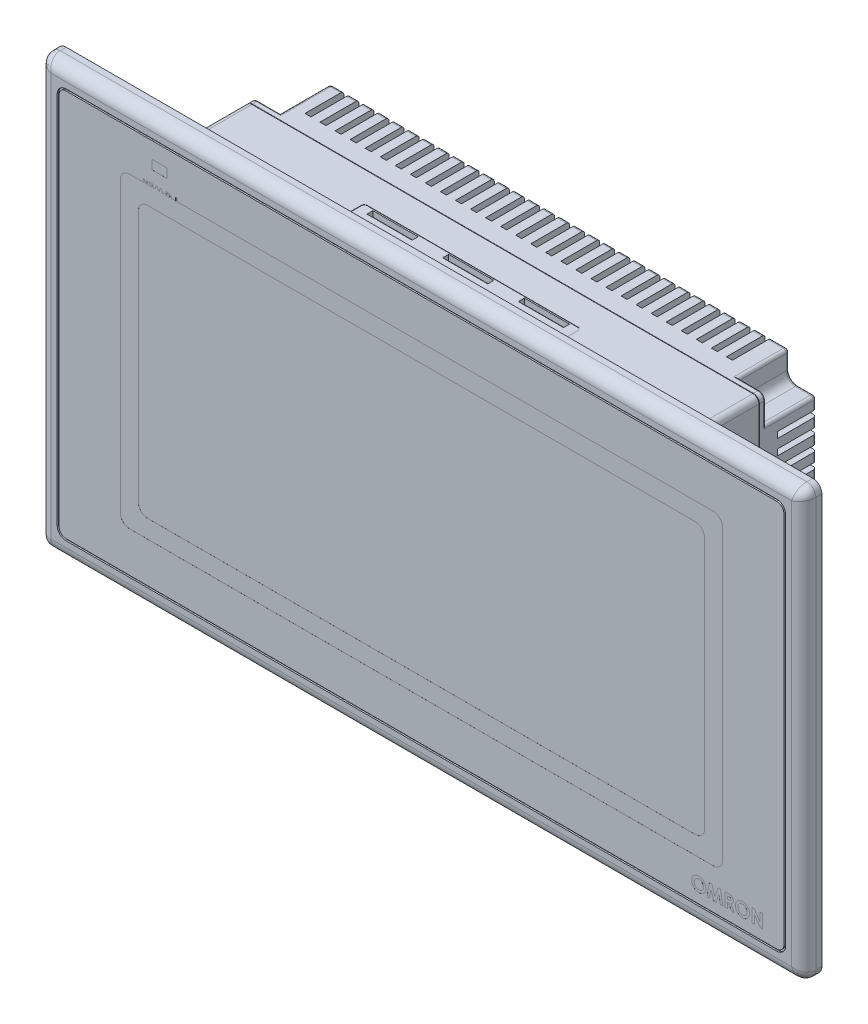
SolidWorks part; units mm, degrees
other "<RS232>-<Boss-Extrude12>"
other "<RS232>-<Cut-Extrude1[2]>"
other "<RS232>-<Cut-Extrude1[1]>"
other "<RS232>-<#4-40 Tapped Hole1[2]>"
other "<RS232>-<Boss-Extrude10[4]>"
other "<RS232>-<Boss-Extrude10[3]>"
other "<RS232>-<Boss-Extrude10[2]>"
other "<RS232>-<Boss-Extrude10[1]>"
other "<RS232>-<Boss-Extrude9[4]>"
other "<RS232>-<Boss-Extrude9[3]>"
other "<RS232>-<Boss-Extrude9[2]>"
other "<RS232>-<Boss-Extrude9[1]>"
other "Camera1"
other "Camera3"
ref_plane "Front Plane" through (0, 0, 0) normal (0, 0, 1) x (1, 0, 0)
ref_plane "Top Plane" through (0, 0, 0) normal (0, 1, 0) x (1, 0, 0)
ref_plane "Right Plane" through (0, 0, 0) normal (1, 0, 0) x (0, 0, -1)
sketch "Sketch1" plane through (0, 0, 0) normal (0, 0, 1) x (1, 0, 0)
  line L1 (127, -71) -> (-127, -71)
  line L2 (127, -71) -> (127, 71)
  line L3 (127, 71) -> (-127, 71)
  line L4 (-127, -71) -> (-127, 71)
  line L5 (127, -71) -> (-127, 71) construction
  line L6 (127, 71) -> (-127, -71) construction
  point P0 (0, 0)
  dimension "D1" = 254
  dimension "D2" = 142
extrude "Boss-Extrude1" add sketch "Sketch1" along normal blind 6
fillet "Fillet2" radius 3 4 edges at (127, -71, 3) (-127, -71, 3) (127, 71, 3) (-127, 71, 3)
fillet "Fillet1" radius 4 8 edges at (0, 71, 6) (127, 0, 6) (0, -71, 6) (-127, 0, 6) (-126.1213, -70.1213, 6) (-126.1213, 70.1213, 6) (126.1213, 70.1213, 6) (126.1213, -70.1213, 6)
sketch "Sketch2" plane through (0, 0, 6) normal (0, 0, 1) x (1, 0, 0)
  line L0 (-127, -68) -> (-127, 68) construction
  line L1 (118, -65) -> (-118, -65)
  line L2 (121, -62) -> (121, 62)
  line L3 (118, 65) -> (-118, 65)
  line L4 (-121, -62) -> (-121, 62)
  line L5 (121, -65) -> (-121, 65) construction
  line L6 (121, 65) -> (-121, -65) construction
  line L7 (-124, 71) -> (124, 71) construction
  arc A0 (-118, -65) -> (-121, -62) centre (-118, -62) cw
  arc A1 (118, -65) -> (121, -62) centre (118, -62) ccw
  arc A2 (121, 62) -> (118, 65) centre (118, 62) ccw
  arc A3 (-118, 65) -> (-121, 62) centre (-118, 62) ccw
  point P0 (0, 0)
  dimension "D1" = 3
  dimension "D2" = 6
  dimension "D3" = 6
extrude "Cut-Extrude1" cut sketch "Sketch2" against normal blind 0.5
sketch "Sketch3" plane through (0, 0, 5.5) normal (0, 0, 1) x (1, 0, 0)
  line L9 (120.4, -62) -> (120.4, 62)
  line L10 (-118, -64.4) -> (118, -64.4)
  line L11 (-120.4, 62) -> (-120.4, -62)
  line L12 (118, 64.4) -> (-118, 64.4)
  line L13 (120.4, -62) -> (120.4, 62)
  line L14 (-118, -64.4) -> (118, -64.4)
  line L15 (-120.4, 62) -> (-120.4, -62)
  line L16 (118, 64.4) -> (-118, 64.4)
  arc A8 (120.4, 62) -> (118, 64.4) centre (118, 62) ccw
  arc A9 (118, -64.4) -> (120.4, -62) centre (118, -62) ccw
  arc A10 (-120.4, -62) -> (-118, -64.4) centre (-118, -62) ccw
  arc A11 (-118, 64.4) -> (-120.4, 62) centre (-118, 62) ccw
  arc A12 (120.4, 62) -> (118, 64.4) centre (118, 62) ccw
  arc A13 (118, -64.4) -> (120.4, -62) centre (118, -62) ccw
  arc A14 (-120.4, -62) -> (-118, -64.4) centre (-118, -62) ccw
  arc A15 (-118, 64.4) -> (-120.4, 62) centre (-118, 62) ccw
  dimension "D1" = 0.6
extrude "Boss-Extrude2" add sketch "Sketch3" along normal up to surface (0.5 mm away)
sketch "Sketch4" plane through (0, 0, 6) normal (0, 0, 1) x (1, 0, 0)
  line L0 (-127, -68) -> (-127, 68) construction
  line L1 (97, -51) -> (-97, -51)
  line L2 (100, -48) -> (100, 48)
  line L3 (97, 51) -> (-97, 51)
  line L4 (-100, -48) -> (-100, 48)
  line L5 (100, -51) -> (-100, 51) construction
  line L6 (100, 51) -> (-100, -51) construction
  line L7 (124, -71) -> (-124, -71) construction
  arc A0 (100, 48) -> (97, 51) centre (97, 48) ccw
  arc A1 (97, -51) -> (100, -48) centre (97, -48) ccw
  arc A2 (-97, -51) -> (-100, -48) centre (-97, -48) cw
  arc A3 (-97, 51) -> (-100, 48) centre (-97, 48) ccw
  point P0 (0, 0)
  dimension "D1" = 3
  dimension "D2" = 27
  dimension "D3" = 20
extrude "Cut-Extrude2" cut sketch "Sketch4" against normal blind 0.01
sketch "Sketch5" plane through (0, 0, 5.99) normal (0, 0, 1) x (1, 0, 0)
  line L0 (91, 45) -> (-91, 45)
  line L1 (-94, 42) -> (-94, -42)
  line L2 (-91, -45) -> (91, -45)
  line L3 (94, -42) -> (94, 42)
  line L4 (97, 51) -> (-97, 51)
  line L5 (-100, 48) -> (-100, -48)
  line L6 (-97, -51) -> (97, -51)
  line L7 (100, -48) -> (100, 48)
  line L8 (97, 51) -> (-97, 51) construction
  line L9 (-100, 48) -> (-100, -48)
  line L10 (-97, -51) -> (97, -51) construction
  line L11 (100, -48) -> (100, 48) construction
  line L12 (-94, 48) -> (-94, -48) construction
  line L13 (97, 45) -> (-97, 45) construction
  line L14 (-97, -45) -> (97, -45) construction
  line L15 (94, -48) -> (94, 48) construction
  arc A0 (94, 42) -> (91, 45) centre (91, 42) ccw
  arc A1 (94, -42) -> (91, -45) centre (91, -42) cw
  arc A2 (-91, -45) -> (-94, -42) centre (-91, -42) cw
  arc A3 (-94, 42) -> (-91, 45) centre (-91, 42) cw
  arc A4 (100, 48) -> (97, 51) centre (97, 48) ccw
  arc A5 (-97, 51) -> (-100, 48) centre (-97, 48) ccw
  arc A6 (-100, -48) -> (-97, -51) centre (-97, -48) ccw
  arc A7 (97, -51) -> (100, -48) centre (97, -48) ccw
  arc A8 (100, 48) -> (97, 51) centre (97, 48) ccw construction
  arc A9 (-97, 51) -> (-100, 48) centre (-97, 48) ccw construction
  arc A10 (-100, -48) -> (-97, -51) centre (-97, -48) ccw construction
  arc A11 (97, -51) -> (100, -48) centre (97, -48) ccw construction
  dimension "D3" = 3
  dimension "D1" = 0
  dimension "D2" = 6
extrude "Cut-Extrude3" cut sketch "Sketch5" against normal blind 0.01 contours A3 L1 A2 L2 A1 L3 A0 L0
sketch "Sketch6" plane through (0, 0, 6) normal (0, 0, 1) x (1, 0, 0)
  line L0 (-62.0158, 52) -> (-111.9842, 52) construction
  line L1 (-89.5, 59) -> (-84.5, 59)
  line L2 (-89.5, 59) -> (-89.5, 56)
  line L3 (-89.5, 56) -> (-84.5, 56)
  line L4 (-84.5, 59) -> (-84.5, 56)
  line L5 (97, 51) -> (-97, 51) construction
  line L6 (-87, 56) -> (-87, 52) construction
  line L7 (-127, -68) -> (-127, 68) construction
  line L8 (77, -61) -> (127, -61) construction
  line L9 (124, -71) -> (-124, -71) construction
  line L10 (127, 68) -> (127, -68) construction
  text T0 "<b>POWER</b>" font "Century Gothic" height 2.5
  text T1 "<b>OMRON</b>" font "Century Gothic" height 4.5
  dimension "D1" = 1
  dimension "D2" = 5
  dimension "D3" = 3
  dimension "D4" = 40
  dimension "D5" = 4
  dimension "D6" = 10
  dimension "D7" = 50
extrude "Cut-Extrude4" cut sketch "Sketch6" against normal blind 0.01
sketch "Sketch7" plane through (0, 0, 0) normal (0, 0, -1) x (-1, 0, 0)
  line L1 (85.2, -64.5) -> (-85.2, -64.5)
  line L2 (85.2, -64.5) -> (85.2, 64.5)
  line L3 (85.2, 64.5) -> (-85.2, 64.5)
  line L4 (-85.2, -64.5) -> (-85.2, 64.5)
  line L5 (85.2, -64.5) -> (-85.2, 64.5) construction
  line L6 (85.2, 64.5) -> (-85.2, -64.5) construction
  point P0 (0, 0)
  dimension "D1" = 170.4
  dimension "D2" = 129
extrude "Boss-Extrude3" add sketch "Sketch7" along normal blind 21
fillet "Fillet3" radius 2 4 edges at (-85.2, -64.5, -10.5) (-85.2, 64.5, -10.5) (85.2, -64.5, -10.5) (85.2, 64.5, -10.5)
sketch "Sketch9" plane through (0, 0, -21) normal (0, 0, -1) x (-1, 0, 0)
  line L4 (-83.2, -64.5) -> (83.2, -64.5)
  line L5 (85.2, -62.5) -> (85.2, 62.5)
  line L6 (83.2, 64.5) -> (-83.2, 64.5)
  line L7 (-85.2, 62.5) -> (-85.2, -62.5)
  line L8 (-83.2, -64.5) -> (83.2, -64.5)
  line L9 (85.2, -62.5) -> (85.2, 62.5)
  line L10 (83.2, 64.5) -> (-83.2, 64.5)
  line L11 (-85.2, 62.5) -> (-85.2, -62.5)
  arc A4 (83.2, -64.5) -> (85.2, -62.5) centre (83.2, -62.5) ccw
  arc A5 (85.2, 62.5) -> (83.2, 64.5) centre (83.2, 62.5) ccw
  arc A6 (-83.2, 64.5) -> (-85.2, 62.5) centre (-83.2, 62.5) ccw
  arc A7 (-85.2, -62.5) -> (-83.2, -64.5) centre (-83.2, -62.5) ccw
  arc A8 (83.2, -64.5) -> (85.2, -62.5) centre (83.2, -62.5) ccw
  arc A9 (85.2, 62.5) -> (83.2, 64.5) centre (83.2, 62.5) ccw
  arc A10 (-83.2, 64.5) -> (-85.2, 62.5) centre (-83.2, 62.5) ccw
  arc A11 (-85.2, -62.5) -> (-83.2, -64.5) centre (-83.2, -62.5) ccw
  dimension "D1" = 0
extrude "Boss-Extrude5" add sketch "Sketch9" along normal offset from surface (19 mm away) 40 separate body
sketch "Sketch8" plane through (0, 0, -40) normal (0, 0, -1) x (-1, 0, 0)
  line L0 (83.2, 64.5) -> (-83.2, 64.5) construction
  line L1 (-76.2, 64.5) -> (-85.2, 64.5)
  line L2 (-76.2, 64.5) -> (-76.2, 58.5)
  line L3 (-79.2, 55.5) -> (-85.2, 55.5)
  line L4 (-85.2, 64.5) -> (-85.2, 55.5)
  line L5 (-85.2, 62.5) -> (-85.2, -62.5) construction
  line L6 (85.2, -62.5) -> (85.2, 62.5) construction
  line L7 (76.2, 64.5) -> (85.2, 64.5)
  line L8 (76.2, 64.5) -> (76.2, 58.5)
  line L9 (79.2, 55.5) -> (85.2, 55.5)
  line L10 (85.2, 64.5) -> (85.2, 55.5)
  line L11 (-83.2, -64.5) -> (83.2, -64.5) construction
  line L12 (85.2, -55.5) -> (79.2, -55.5)
  line L13 (85.2, -55.5) -> (85.2, -64.5)
  line L14 (85.2, -64.5) -> (76.2, -64.5)
  line L15 (76.2, -58.5) -> (76.2, -64.5)
  line L16 (-83.2, -64.5) -> (83.2, -64.5) construction
  line L17 (-85.2, -55.5) -> (-79.2, -55.5)
  line L18 (-85.2, -55.5) -> (-85.2, -64.5)
  line L19 (-85.2, -64.5) -> (-76.2, -64.5)
  line L20 (-76.2, -58.5) -> (-76.2, -64.5)
  arc A0 (76.2, 58.5) -> (79.2, 55.5) centre (79.2, 58.5) ccw
  arc A1 (79.2, -55.5) -> (76.2, -58.5) centre (79.2, -58.5) ccw
  arc A2 (-79.2, -55.5) -> (-76.2, -58.5) centre (-79.2, -58.5) cw
  arc A3 (-76.2, 58.5) -> (-79.2, 55.5) centre (-79.2, 58.5) cw
  dimension "D1" = 3
  dimension "D2" = 9
  dimension "D3" = 9
extrude "Cut-Extrude5" cut sketch "Sketch8" against normal blind 17
fillet "Fillet4" radius 1 8 edges at (76.2, -64.5, -31.5) (85.2, -55.5, -31.5) (-76.2, -64.5, -31.5) (-85.2, -55.5, -31.5) (-85.2, 55.5, -31.5) (-76.2, 64.5, -31.5) (85.2, 55.5, -31.5) (76.2, 64.5, -31.5)
fillet "Fillet5" radius 1 20 edges at (81.7, -55.5, -40) (76.2, -61, -40) (85.2, 0, -40) (0, -64.5, -40) (-81.7, -55.5, -40) (-85.2, 0, -40) (-76.2, 61, -40) (0, 64.5, -40) (81.7, 55.5, -40) (75.9071, 64.2071, -40) (84.9071, 55.2071, -40) (-75.9071, 64.2071, -40) (-84.9071, 55.2071, -40) (-84.9071, -55.2071, -40) (-75.9071, -64.2071, -40) (84.9071, -55.2071, -40) (75.9071, -64.2071, -40) (76.2, 61, -40) (-81.7, 55.5, -40) (-76.2, -61, -40)
sketch "Sketch10" plane through (0, 0, -40) normal (0, 0, -1) x (-1, 0, 0)
  line L0 (-75.2, 64.5) -> (75.2, 64.5) construction
  line L1 (-70.2, 64.5) -> (-68.2, 64.5)
  line L2 (-70.2, 64.5) -> (-70.2, 60)
  line L3 (-70.2, 60) -> (-68.2, 60)
  line L4 (-68.2, 64.5) -> (-68.2, 60)
  line L5 (-76.2, 58.5) -> (-76.2, 63.5) construction
  line L6 (-84.2, 0) -> (0, 0) construction
  line L7 (-84.2, 54.5) -> (-84.2, -54.5) construction
  line L8 (-68.2, -64.5) -> (-68.2, -60)
  line L9 (-70.2, -60) -> (-68.2, -60)
  line L10 (-70.2, -64.5) -> (-70.2, -60)
  line L11 (-70.2, -64.5) -> (-68.2, -64.5)
  point P6 (-76.2, 61)
  dimension "D1" = 2
  dimension "D2" = 6
  dimension "D3" = 4.5
extrude "Cut-Extrude6" cut sketch "Sketch10" against normal blind 12.9
pattern_linear "LPattern1" count 29 spacing 5 along (-1, 0, 0) of "Cut-Extrude6"
sketch "Sketch11" plane through (0, 0, -40) normal (0, 0, -1) x (-1, 0, 0)
  line L0 (-85.2, 62.5) -> (-85.2, -62.5) construction
  line L1 (-85.2, 51.5) -> (-80.7, 51.5)
  line L2 (-85.2, 51.5) -> (-85.2, 49.5)
  line L3 (-85.2, 49.5) -> (-80.7, 49.5)
  line L4 (-80.7, 51.5) -> (-80.7, 49.5)
  line L5 (-70.2, 64.5) -> (-70.2, 60) construction
  line L6 (-70.2, 60) -> (-68.2, 60) construction
  line L7 (0, 0) -> (0, 71) construction
  line L8 (-124, 71) -> (124, 71) construction
  line L9 (80.7, 51.5) -> (80.7, 49.5)
  line L10 (85.2, 49.5) -> (80.7, 49.5)
  line L11 (85.2, 51.5) -> (85.2, 49.5)
  line L12 (85.2, 51.5) -> (80.7, 51.5)
  line L13 (-79.2, 54.5) -> (-84.2, 54.5) construction
  point P19 (-81.7, 54.5)
  dimension "D1" = 3
extrude "Cut-Extrude7" cut sketch "Sketch11" against normal up to surface (12.9 mm away)
pattern_linear "LPattern2" count 21 spacing 5 along (0, -1, 0) of "Cut-Extrude7"
sketch "Sketch14" plane through (40.2, 0, 0) normal (1, 0, 0) x (0, 0, -1)
  line L4 (40, -63.5) -> (40, -60)
  line L5 (40, -60) -> (27.1, -60)
  line L6 (27.1, -60) -> (27.1, -64.5)
  line L7 (27.1, -64.5) -> (39, -64.5)
  line L8 (40, -63.5) -> (40, -60)
  line L9 (40, -60) -> (27.1, -60)
  line L10 (27.1, -60) -> (27.1, -64.5)
  line L11 (27.1, -64.5) -> (39, -64.5)
  arc A1 (39, -64.5) -> (40, -63.5) centre (39, -63.5) ccw
  arc A2 (39, -64.5) -> (40, -63.5) centre (39, -63.5) ccw
  dimension "D1" = 0
extrude "Boss-Extrude6" add sketch "Sketch14" against normal up to surface (112 mm away)
sketch "Sketch12" plane through (0, 0, -40) normal (0, 0, -1) x (-1, 0, 0)
  line L0 (-83.2, -64.5) -> (83.2, -64.5) construction
  line L1 (-36.8, -20.5) -> (62.2, -20.5)
  line L2 (-39.8, -23.5) -> (-39.8, -64.5)
  line L3 (-39.8, -64.5) -> (65.2, -64.5)
  line L4 (65.2, -23.5) -> (65.2, -64.5)
  line L5 (85.2, -62.5) -> (85.2, 62.5) construction
  line L6 (83.2, 64.5) -> (-83.2, 64.5) construction
  arc A0 (62.2, -20.5) -> (65.2, -23.5) centre (62.2, -23.5) cw
  arc A1 (-36.8, -20.5) -> (-39.8, -23.5) centre (-36.8, -23.5) ccw
  point P12 (65.2, -20.5)
  point P15 (-39.8, -20.5)
  dimension "D4" = 3
  dimension "D1" = 105
  dimension "D2" = 20
  dimension "D3" = 85
extrude "Cut-Extrude8" cut sketch "Sketch12" against normal blind 6.5
sketch "Sketch13" plane through (0, 0, -33.5) normal (0, 0, -1) x (-1, 0, 0)
  line L0 (62.2, -20.5) -> (-36.8, -20.5) construction
  line L1 (21.2, -20.5) -> (62.2, -20.5)
  line L2 (20.2, -21.5) -> (20.2, -64.5)
  line L3 (20.2, -64.5) -> (65.2, -64.5)
  line L4 (65.2, -23.5) -> (65.2, -64.5)
  line L5 (65.2, -63.5) -> (65.2, -23.5) construction
  arc A0 (21.2, -20.5) -> (20.2, -21.5) centre (21.2, -21.5) ccw
  arc A1 (65.2, -23.5) -> (62.2, -20.5) centre (62.2, -23.5) ccw construction
  arc A2 (65.2, -23.5) -> (62.2, -20.5) centre (62.2, -23.5) ccw
  point P12 (20.2, -20.5)
  dimension "D1" = 1
  dimension "D2" = 45
extrude "Cut-Extrude9" cut sketch "Sketch13" against normal blind 4.3
sketch "Sketch15" plane through (0, 0, -40) normal (0, 0, -1) x (-1, 0, 0)
  line L0 (-85.2, 62.5) -> (-85.2, -62.5) construction
  line L1 (-71.2, -16.5) -> (-85.2, -16.5)
  line L2 (-71.2, -16.5) -> (-71.2, -43.5)
  line L3 (-71.2, -43.5) -> (-85.2, -43.5)
  line L4 (-85.2, -16.5) -> (-85.2, -43.5)
  line L5 (-83.2, -64.5) -> (83.2, -64.5) construction
  dimension "D1" = 27
  dimension "D2" = 14
  dimension "D3" = 21
extrude "Cut-Extrude10" cut sketch "Sketch15" against normal blind 12.3
sketch "Sketch16" plane through (0, 0, -27.7) normal (0, 0, -1) x (-1, 0, 0)
  line L0 (-85.2, -40.5) -> (-85.2, -43.5) construction
  line L1 (-71.2, -16.5) -> (-85.2, -16.5)
  line L2 (-71.2, -16.5) -> (-71.2, -43.5)
  line L3 (-71.2, -43.5) -> (-85.2, -43.5)
  line L4 (-85.2, -16.5) -> (-85.2, -43.5)
extrude "Boss-Extrude7" add sketch "Sketch16" against normal up to next
sketch "Sketch17" plane through (0, -45.5, 0) normal (0, 1, 0) x (1, 0, 0)
  line L4 (84.2, 40) -> (80.7, 40)
  line L5 (80.7, 40) -> (80.7, 27.1)
  line L6 (80.7, 27.1) -> (85.2, 27.1)
  line L7 (85.2, 27.1) -> (85.2, 39)
  line L8 (84.2, 40) -> (80.7, 40)
  line L9 (80.7, 40) -> (80.7, 27.1)
  line L10 (80.7, 27.1) -> (85.2, 27.1)
  line L11 (85.2, 27.1) -> (85.2, 39)
  arc A1 (85.2, 39) -> (84.2, 40) centre (84.2, 39) ccw
  arc A2 (85.2, 39) -> (84.2, 40) centre (84.2, 39) ccw
  dimension "D1" = 0
extrude "Boss-Extrude8" add sketch "Sketch17" along normal up to surface (2 mm away)
sketch "Sketch18" plane through (0, -15.5, 0) normal (0, 1, 0) x (1, 0, 0)
  line L4 (84.2, 40) -> (80.7, 40)
  line L5 (80.7, 40) -> (80.7, 27.1)
  line L6 (80.7, 27.1) -> (85.2, 27.1)
  line L7 (85.2, 27.1) -> (85.2, 39)
  line L8 (84.2, 40) -> (80.7, 40)
  line L9 (80.7, 40) -> (80.7, 27.1)
  line L10 (80.7, 27.1) -> (85.2, 27.1)
  line L11 (85.2, 27.1) -> (85.2, 39)
  arc A1 (85.2, 39) -> (84.2, 40) centre (84.2, 39) ccw
  arc A2 (85.2, 39) -> (84.2, 40) centre (84.2, 39) ccw
  dimension "D1" = 0
extrude "Boss-Extrude9" add sketch "Sketch18" along normal up to next
sketch "Sketch19" plane through (0, 0, -21) normal (0, 0, -1) x (-1, 0, 0)
  line L8 (-83.2, -62.5) -> (83.2, -62.5)
  line L9 (83.2, -62.5) -> (83.2, 62.5)
  line L10 (83.2, 62.5) -> (-83.2, 62.5)
  line L11 (-83.2, 62.5) -> (-83.2, -62.5)
  line L12 (-83.2, -62.5) -> (83.2, -62.5)
  line L13 (83.2, -62.5) -> (83.2, 62.5)
  line L14 (83.2, 62.5) -> (-83.2, 62.5)
  line L15 (-83.2, 62.5) -> (-83.2, -62.5)
  dimension "D1" = 2
extrude "Cut-Extrude11" cut sketch "Sketch19" against normal offset from surface (19 mm away) 2
sketch "Sketch20" plane through (0, 0, -27.7) normal (0, 0, -1) x (-1, 0, 0)
  line L0 (-85.2, -43.5) -> (-71.2, -43.5) construction
  line L1 (-71.2, -16.5) -> (-82.2, -16.5)
  line L2 (-71.2, -16.5) -> (-71.2, -43.5)
  line L3 (-71.2, -43.5) -> (-82.2, -43.5)
  line L4 (-82.2, -16.5) -> (-82.2, -43.5)
  line L5 (-85.2, -16.5) -> (-85.2, -43.5) construction
  point P7 (-85.2, -30)
  dimension "D1" = 3
extrude "Cut-Extrude12" cut sketch "Sketch20" against normal blind 20 and the other way through all
shell "Shell3" thickness 2
sketch "Sketch21" plane through (0, 0, -25.1) normal (0, 0, 1) x (1, 0, 0)
  line L0 (-78.7, 53.5) -> (-79.2, 53.5) construction
  line L1 (-79.2, 53.5) -> (-83.2, 53.5) construction
  line L2 (-83.2, 53.5) -> (-83.2, -52.5) construction
  line L3 (-83.2, -52.5) -> (-78.7, -52.5) construction
  line L4 (-73.8, 58) -> (72.2, 58)
  line L5 (72.2, 58) -> (72.2, 62.5)
  line L6 (72.2, 62.5) -> (-73.8, 62.5)
  line L7 (-73.8, 62.5) -> (-73.8, 58)
  line L8 (-73.8, 58) -> (72.2, 58)
  line L9 (72.2, 58) -> (72.2, 62.5)
  line L10 (72.2, 62.5) -> (-73.8, 62.5)
  line L11 (-73.8, 62.5) -> (-73.8, 58)
  line L12 (-78.7, -52.5) -> (-78.7, 53.5) construction
  line L13 (72.2, -58) -> (41.2, -58) construction
  line L14 (41.2, -58) -> (41.2, -62.5) construction
  line L15 (41.2, -62.5) -> (72.2, -62.5) construction
  line L16 (72.2, -62.5) -> (72.2, -58) construction
  line L17 (83.2, 53.5) -> (79.2, 53.5) construction
  line L18 (79.2, 53.5) -> (78.7, 53.5) construction
  line L19 (78.7, 53.5) -> (78.7, -12.5) construction
  line L20 (78.7, -12.5) -> (83.2, -12.5) construction
  line L21 (83.2, -12.5) -> (83.2, 53.5) construction
  line L22 (-78.7, 53.5) -> (-79.2, 53.5)
  line L23 (-79.2, 53.5) -> (-83.2, 53.5)
  line L24 (-83.2, 53.5) -> (-83.2, -52.5)
  line L25 (-83.2, -52.5) -> (-78.7, -52.5)
  line L26 (-78.7, -52.5) -> (-78.7, 53.5)
  line L27 (72.2, -58) -> (41.2, -58)
  line L28 (41.2, -58) -> (41.2, -62.5)
  line L29 (41.2, -62.5) -> (72.2, -62.5)
  line L30 (72.2, -62.5) -> (72.2, -58)
  line L31 (83.2, 53.5) -> (79.2, 53.5)
  line L32 (79.2, 53.5) -> (78.7, 53.5)
  line L33 (78.7, 53.5) -> (78.7, -12.5)
  line L34 (78.7, -12.5) -> (83.2, -12.5)
  line L35 (83.2, -12.5) -> (83.2, 53.5)
  dimension "D1" = 0
extrude "Cut-Extrude13" cut sketch "Sketch21" against normal blind 10
sketch "Sketch25" plane through (0, 64.5, 0) normal (0, 1, 0) x (1, 0, 0)
  line L0 (0, 0) -> (0, 7) construction
  line L1 (124, 0) -> (-124, 0) construction
  line L2 (-83.2, 0) -> (83.2, 0) construction
  line L3 (-35, 11) -> (35, 11)
  line L4 (-36, 10) -> (-36, 4)
  line L5 (-35, 3) -> (35, 3)
  line L6 (36, 10) -> (36, 4)
  line L7 (-36, 11) -> (36, 3) construction
  line L8 (-36, 3) -> (36, 11) construction
  arc A0 (35, 3) -> (36, 4) centre (35, 4) ccw
  arc A1 (35, 11) -> (36, 10) centre (35, 10) cw
  arc A2 (-36, 4) -> (-35, 3) centre (-35, 4) ccw
  arc A3 (-35, 11) -> (-36, 10) centre (-35, 10) ccw
  dimension "D4" = 1
  dimension "D1" = 72
  dimension "D2" = 8
  dimension "D3" = 3
extrude "Cut-Extrude15" cut sketch "Sketch25" against normal blind 0.1
sketch "Sketch26" plane through (0, 64.4, 0) normal (0, 1, 0) x (1, 0, 0)
  line L0 (0, 11) -> (0, 3) construction
  line L1 (35, 11) -> (-35, 11) construction
  line L2 (-35, 3) -> (35, 3) construction
  line L3 (0, 7) -> (36, 7) construction
  line L4 (-7.5, 10.55) -> (7.5, 10.55)
  line L5 (-7.5, 10.55) -> (-7.5, 8.55)
  line L6 (-7.5, 8.55) -> (7.5, 8.55)
  line L7 (7.5, 10.55) -> (7.5, 8.55)
  line L8 (-7.5, 10.55) -> (7.5, 8.55) construction
  line L9 (-7.5, 8.55) -> (7.5, 10.55) construction
  line L10 (36, 4) -> (36, 10) construction
  line L11 (0, 9.55) -> (25.15, 9.55) construction
  line L12 (-32.65, 8.55) -> (-17.65, 10.55) construction
  line L13 (32.65, 10.55) -> (17.65, 10.55)
  line L14 (32.65, 10.55) -> (32.65, 8.55)
  line L15 (32.65, 8.55) -> (17.65, 8.55)
  line L16 (17.65, 10.55) -> (17.65, 8.55)
  line L17 (32.65, 10.55) -> (17.65, 8.55) construction
  line L18 (32.65, 8.55) -> (17.65, 10.55) construction
  line L19 (-32.65, 10.55) -> (-17.65, 8.55) construction
  line L20 (-17.65, 10.55) -> (-17.65, 8.55)
  line L21 (-32.65, 8.55) -> (-17.65, 8.55)
  line L22 (-32.65, 10.55) -> (-32.65, 8.55)
  line L23 (-32.65, 10.55) -> (-17.65, 10.55)
  line L24 (-32.65, 3.45) -> (-17.65, 5.45) construction
  line L25 (32.65, 5.45) -> (17.65, 3.45) construction
  line L26 (32.65, 3.45) -> (17.65, 5.45) construction
  line L27 (-32.65, 5.45) -> (-17.65, 3.45) construction
  line L28 (0, 4.45) -> (25.15, 4.45) construction
  line L29 (-7.5, 5.45) -> (7.5, 3.45) construction
  line L30 (-7.5, 3.45) -> (7.5, 5.45) construction
  line L31 (-32.65, 3.45) -> (-17.65, 3.45)
  line L32 (-32.65, 3.45) -> (-32.65, 5.45)
  line L33 (-32.65, 5.45) -> (-17.65, 5.45)
  line L34 (-17.65, 3.45) -> (-17.65, 5.45)
  line L35 (17.65, 3.45) -> (17.65, 5.45)
  line L36 (32.65, 5.45) -> (17.65, 5.45)
  line L37 (32.65, 3.45) -> (32.65, 5.45)
  line L38 (32.65, 3.45) -> (17.65, 3.45)
  line L39 (7.5, 3.45) -> (7.5, 5.45)
  line L40 (-7.5, 5.45) -> (7.5, 5.45)
  line L41 (-7.5, 3.45) -> (-7.5, 5.45)
  line L42 (-7.5, 3.45) -> (7.5, 3.45)
  point P6 (0, 9.55)
  dimension "D1" = 15
  dimension "D2" = 2
  dimension "D3" = 65.3
  dimension "D4" = 7.1
extrude "Cut-Extrude16" cut sketch "Sketch26" against normal up to next
fillet "Fillet6" radius 0.1
chamfer "Chamfer1" distance 0.1 angle 45
sketch "Sketch34" plane through (0, 0, -29.2) normal (0, 0, -1) x (-1, 0, 0)
  line L0 (42.7, -20.5) -> (42.7, -64.5) construction
  line L1 (26.5, -23.5) -> (38.2, -23.5)
  line L2 (25.5, -24.5) -> (25.5, -54.5)
  line L3 (26.5, -55.5) -> (38.2, -55.5)
  line L4 (39.2, -24.5) -> (39.2, -54.5)
  line L5 (25.5, -23.5) -> (39.2, -55.5) construction
  line L6 (25.5, -55.5) -> (39.2, -23.5) construction
  line L8 (20.2, -64.5) -> (65.2, -64.5) construction
  line L9 (62.2, -20.5) -> (-36.8, -20.5) construction
  line L10 (59.9, -55.5) -> (46.2, -23.5) construction
  line L11 (59.9, -23.5) -> (46.2, -55.5) construction
  line L12 (46.2, -24.5) -> (46.2, -54.5)
  line L13 (58.9, -55.5) -> (47.2, -55.5)
  line L14 (59.9, -24.5) -> (59.9, -54.5)
  line L15 (58.9, -23.5) -> (47.2, -23.5)
  arc A0 (38.2, -23.5) -> (39.2, -24.5) centre (38.2, -24.5) cw
  arc A1 (38.2, -55.5) -> (39.2, -54.5) centre (38.2, -54.5) ccw
  arc A2 (25.5, -54.5) -> (26.5, -55.5) centre (26.5, -54.5) ccw
  arc A3 (26.5, -23.5) -> (25.5, -24.5) centre (26.5, -24.5) ccw
  arc A4 (58.9, -23.5) -> (59.9, -24.5) centre (58.9, -24.5) cw
  arc A5 (59.9, -54.5) -> (58.9, -55.5) centre (58.9, -54.5) cw
  arc A6 (47.2, -55.5) -> (46.2, -54.5) centre (47.2, -54.5) cw
  arc A7 (47.2, -23.5) -> (46.2, -24.5) centre (47.2, -24.5) ccw
  point P0 (32.35, -39.5)
  point P39 (53.05, -39.5)
  dimension "D1" = 1
  dimension "D2" = 13.7
  dimension "D3" = 32
  dimension "D4" = 3
  dimension "D5" = 7
extrude "Cut-Extrude18" cut sketch "Sketch34" against normal blind 15
sketch "Sketch35" plane through (0, 0, -33.5) normal (0, 0, -1) x (-1, 0, 0)
  line L0 (-39.8, -23.5) -> (-39.8, -64.5) construction
  line L1 (-35.8, -41.1) -> (-23.1, -41.1)
  line L2 (-35.8, -41.1) -> (-35.8, -54.6)
  line L3 (-35.8, -54.6) -> (-23.1, -54.6)
  line L4 (-23.1, -41.1) -> (-23.1, -54.6)
  line L5 (-35.8, -41.1) -> (-23.1, -54.6) construction
  line L6 (-35.8, -54.6) -> (-23.1, -41.1) construction
  line L7 (-17.1, -40) -> (-8.7, -40)
  line L8 (-17.1, -40) -> (-17.1, -55.6)
  line L9 (-17.1, -55.6) -> (-8.7, -55.6)
  line L10 (-8.7, -40) -> (-8.7, -55.6)
  line L11 (-17.1, -40) -> (-8.7, -55.6) construction
  line L12 (-17.1, -55.6) -> (-8.7, -40) construction
  line L13 (-3.6, -38.3) -> (13.4, -38.3)
  line L14 (-3.6, -38.3) -> (-3.6, -56.6)
  line L15 (-3.6, -56.6) -> (13.4, -56.6)
  line L16 (13.4, -38.3) -> (13.4, -56.6)
  line L17 (-3.6, -38.3) -> (13.4, -56.6) construction
  line L18 (-3.6, -56.6) -> (13.4, -38.3) construction
  line L19 (-14.7, -25.2) -> (-5.3, -25.2)
  line L20 (-14.7, -25.2) -> (-14.7, -34.6)
  line L21 (-14.7, -34.6) -> (-5.3, -34.6)
  line L22 (-5.3, -25.2) -> (-5.3, -34.6)
  line L23 (-14.7, -25.2) -> (-5.3, -34.6) construction
  line L24 (-14.7, -34.6) -> (-5.3, -25.2) construction
  line L25 (-83.2, -64.5) -> (83.2, -64.5) construction
  line L26 (-39.8, -23.5) -> (-39.8, -63.5) construction
  circle A0 centre (-33.4, -30.5) radius 2
  circle A1 centre (-22.4, -30.5) radius 2.65
  point P0 (-29.45, -47.85)
  point P5 (-12.9, -47.8)
  point P10 (4.9, -47.45)
  point P15 (-10, -29.9)
  dimension "D16" = 5.3
  dimension "D17" = 4
  dimension "D19" = 34
  dimension "D1" = 12.7
  dimension "D2" = 13.5
  dimension "D3" = 4
  dimension "D4" = 9.9
  dimension "D5" = 22.7
  dimension "D6" = 36.2
  dimension "D7" = 17
  dimension "D8" = 7.9
  dimension "D9" = 8.9
  dimension "D10" = 15.6
  dimension "D11" = 18.3
  dimension "D12" = 8.4
  dimension "D13" = 9.4
  dimension "D14" = 25.1
  dimension "D15" = 29.9
  dimension "D18" = 11
  dimension "D20" = 6.4
extrude "Cut-Extrude19" cut sketch "Sketch35" against normal up to surface (31.5 mm away)
sketch "Sketch36" plane through (0, 0, -40) normal (0, 0, -1) x (-1, 0, 0)
  line L0 (83.2, 64.5) -> (-83.2, 64.5) construction
  line L1 (-23.8777, 23.5) -> (23.8777, 23.5)
  line L2 (-25.5, 21.8777) -> (-25.5, -0.8777)
  line L3 (-23.8777, -2.5) -> (23.8777, -2.5)
  line L4 (25.5, 21.8777) -> (25.5, -0.8777)
  line L5 (-25.5, 23.5) -> (25.5, -2.5) construction
  line L6 (-25.5, -2.5) -> (25.5, 23.5) construction
  line L7 (0, 10.5) -> (0, 0) construction
  arc A0 (23.8777, 23.5) -> (25.5, 21.8777) centre (23.8777, 21.8777) cw
  arc A1 (23.8777, -2.5) -> (25.5, -0.8777) centre (23.8777, -0.8777) ccw
  arc A2 (-25.5, -0.8777) -> (-23.8777, -2.5) centre (-23.8777, -0.8777) ccw
  arc A3 (-23.8777, 23.5) -> (-25.5, 21.8777) centre (-23.8777, 21.8777) ccw
  point P0 (0, 10.5)
  dimension "D1" = 1.6223
  dimension "D2" = 41
  dimension "D3" = 51
  dimension "D4" = 26
extrude "Cut-Extrude20" cut sketch "Sketch36" against normal blind 0.2
inserted part "RS232"
move or copy body "Body-Move/Copy2" placed by mates yes
other "Distance1" parameters "D1"=3.2
other "Distance2" parameters "D1"=0.5
other "Distance3" parameters "D1"=7
sketch "Sketch37" plane through (0, 0, -26) normal (0, 0, -1) x (-1, 0, 0)
  line L1 (34.2318, -28.9515) -> (35.0141, -26.4135)
  line L2 (35.0141, -26.4135) -> (33.2073, -24.467)
  line L3 (33.2073, -24.467) -> (30.6182, -25.0585)
  line L4 (30.6182, -25.0585) -> (29.8359, -27.5965)
  line L5 (29.8359, -27.5965) -> (31.6427, -29.543)
  line L6 (31.6427, -29.543) -> (34.2318, -28.9515)
  line L7 (34.1353, -49.9632) -> (31.5205, -49.498)
  line L8 (31.5205, -49.498) -> (29.8103, -51.5298)
  line L9 (29.8103, -51.5298) -> (30.7147, -54.0268)
  line L10 (30.7147, -54.0268) -> (33.3295, -54.492)
  line L11 (33.3295, -54.492) -> (35.0397, -52.4602)
  line L12 (35.0397, -52.4602) -> (34.1353, -49.9632)
  circle A0 centre (32.425, -27.005) radius 2.3 construction
  circle A1 centre (32.425, -51.995) radius 2.3 construction
  dimension "D1" = 4.6
extrude "Boss-Extrude18" add sketch "Sketch37" along normal blind 6.4
chamfer "Chamfer2" distance 0.2 angle 45 12 edges at (-34.1846, -53.4761, -32.4) (-32.0221, -54.2594, -32.4) (-30.2625, -52.7783, -32.4) (-30.6654, -50.5139, -32.4) (-32.8279, -49.7306, -32.4) (-34.5875, -51.2117, -32.4) (-30.7393, -28.5697, -32.4) (-30.227, -26.3275, -32.4) (-31.9128, -24.7628, -32.4) (-34.1107, -25.4403, -32.4) (-34.623, -27.6825, -32.4) (-32.9372, -29.2472, -32.4)
pattern_linear "LPattern3" count 2 spacing 20.7
sketch "Sketch47" plane through (0, 0, -2) normal (0, 0, -1) x (-1, 0, 0)
  line L0 (-29.45, -41.1) -> (-29.45, -54.6) construction
  line L1 (-23.1, -41.1) -> (-35.8, -41.1) construction
  line L2 (-35.8, -54.6) -> (-23.1, -54.6) construction
  line L4 (-34.95, -41.85) -> (-23.95, -41.85)
  line L5 (-35.45, -42.35) -> (-35.45, -53.35)
  line L6 (-34.95, -53.85) -> (-23.95, -53.85)
  line L7 (-23.45, -42.35) -> (-23.45, -53.35)
  line L8 (-35.45, -41.85) -> (-23.45, -53.85) construction
  line L9 (-35.45, -53.85) -> (-23.45, -41.85) construction
  arc A0 (-34.95, -41.85) -> (-35.45, -42.35) centre (-34.95, -42.35) ccw
  arc A1 (-23.95, -41.85) -> (-23.45, -42.35) centre (-23.95, -42.35) cw
  arc A2 (-23.95, -53.85) -> (-23.45, -53.35) centre (-23.95, -53.35) ccw
  arc A3 (-35.45, -53.35) -> (-34.95, -53.85) centre (-34.95, -53.35) ccw
  point P6 (-29.45, -47.85)
  dimension "D3" = 0.5
  dimension "D1" = 12
  dimension "D2" = 12
extrude "Boss-Extrude19" add sketch "Sketch47" along normal offset from surface (32 mm away) 0.5 separate body
sketch "Sketch48" plane through (0, 0, -34) normal (0, 0, -1) x (-1, 0, 0)
  line L0 (-35.45, -47.85) -> (-23.45, -47.85) construction
  line L1 (-35.45, -42.35) -> (-35.45, -53.35) construction
  line L2 (-23.45, -53.35) -> (-23.45, -42.35) construction
  line L3 (-33.05, -52.1) -> (-33.05, -43.6)
  line L4 (-33.05, -43.6) -> (-25.95, -43.6)
  line L5 (-25.95, -43.6) -> (-24.75, -44.8)
  line L6 (-24.75, -44.8) -> (-24.75, -50.9)
  line L7 (-25.95, -52.1) -> (-24.75, -50.9)
  line L8 (-33.05, -52.1) -> (-25.95, -52.1)
  point P12 (-24.75, -47.85)
  point P14 (-33.05, -47.85)
  dimension "D1" = 1.3
  dimension "D2" = 8.5
  dimension "D3" = 8.3
  dimension "D4" = 135
  dimension "D5" = 1.2
extrude "Cut-Extrude21" cut sketch "Sketch48" against normal blind 9
sketch "Sketch49" plane through (0, 0, -25) normal (0, 0, -1) x (-1, 0, 0)
  line L0 (-25.9914, -43.7) -> (-32.95, -43.7)
  line L1 (-32.95, -43.7) -> (-32.95, -52)
  line L2 (-32.95, -52) -> (-25.9914, -52)
  line L3 (-25.9914, -52) -> (-24.85, -50.8586)
  line L4 (-24.85, -50.8586) -> (-24.85, -44.8414)
  line L5 (-24.85, -44.8414) -> (-25.9914, -43.7)
  line L6 (-25.95, -43.6) -> (-33.05, -43.6)
  line L7 (-33.05, -43.6) -> (-33.05, -52.1)
  line L8 (-33.05, -52.1) -> (-25.95, -52.1)
  line L9 (-25.95, -52.1) -> (-24.75, -50.9)
  line L10 (-24.75, -50.9) -> (-24.75, -44.8)
  line L11 (-24.75, -44.8) -> (-25.95, -43.6)
  line L12 (-25.95, -43.6) -> (-33.05, -43.6)
  line L13 (-33.05, -43.6) -> (-33.05, -52.1)
  line L14 (-33.05, -52.1) -> (-25.95, -52.1)
  line L15 (-25.95, -52.1) -> (-24.75, -50.9)
  line L16 (-24.75, -50.9) -> (-24.75, -44.8)
  line L17 (-24.75, -44.8) -> (-25.95, -43.6)
  dimension "D1" = 0
  dimension "D2" = 0.1
extrude "Boss-Extrude20" add sketch "Sketch49" along normal offset from surface (8.5 mm away) 0.5 separate body
sketch "Sketch50" plane through (0, 0, -25) normal (0, 0, -1) x (-1, 0, 0)
  line L0 (-32.95, -47.85) -> (-24.75, -47.85) construction
  line L1 (-32.95, -43.7) -> (-32.95, -52) construction
  line L2 (-24.75, -50.9) -> (-24.75, -44.8) construction
  line L5 (-30.45, -50.6) -> (-27.25, -50.6)
  line L6 (-30.45, -50.6) -> (-30.45, -45.1)
  line L7 (-30.45, -45.1) -> (-27.25, -45.1)
  line L8 (-27.25, -50.6) -> (-27.25, -45.1)
  line L9 (-30.45, -50.6) -> (-27.25, -45.1) construction
  line L10 (-30.45, -45.1) -> (-27.25, -50.6) construction
  point P7 (-28.85, -47.85)
  dimension "D1" = 3.2
  dimension "D2" = 5.5
extrude "Boss-Extrude21" add sketch "Sketch50" along normal up to surface (8.5 mm away) separate body
chamfer "Chamfer3" distance 0.2 angle 45 4 edges at (30.45, -47.85, -33.5) (28.85, -45.1, -33.5) (27.25, -47.85, -33.5) (28.85, -50.6, -33.5)
sketch "Sketch51" plane through (0, 0, -31.5) normal (0, 0, 1) x (1, 0, 0)
  line L0 (-4.9, -38.3) -> (-4.9, -56.6) construction
  line L1 (-13.4, -38.3) -> (3.6, -38.3) construction
  line L2 (3.6, -56.6) -> (-13.4, -56.6) construction
  line L3 (12.9, -40) -> (12.9, -55.6) construction
  line L4 (8.7, -40) -> (17.1, -40) construction
  line L5 (17.1, -55.6) -> (8.7, -55.6) construction
  line L6 (3.6, -38.3) -> (3.6, -56.6) construction
  line L7 (-13.4, -48.2) -> (-5.65, -48.2)
  line L8 (-13.4, -48.2) -> (-13.4, -46.7)
  line L9 (-13.4, -46.7) -> (-5.65, -46.7)
  line L10 (3.6, -48.2) -> (3.6, -46.7)
  line L11 (-13.4, -48.2) -> (3.6, -46.7) construction
  line L12 (-13.4, -46.7) -> (3.6, -48.2) construction
  line L13 (17.1, -40) -> (17.1, -55.6) construction
  line L14 (8.7, -48.55) -> (12.15, -48.55)
  line L15 (8.7, -48.55) -> (8.7, -47.05)
  line L16 (8.7, -47.05) -> (12.15, -47.05)
  line L17 (17.1, -48.55) -> (17.1, -47.05)
  line L18 (8.7, -48.55) -> (17.1, -47.05) construction
  line L19 (8.7, -47.05) -> (17.1, -48.55) construction
  line L20 (12.15, -47.05) -> (12.15, -40)
  line L21 (12.15, -55.6) -> (13.65, -55.6)
  line L22 (12.15, -55.6) -> (12.15, -48.55)
  line L23 (12.15, -40) -> (13.65, -40)
  line L24 (13.65, -55.6) -> (13.65, -48.55)
  line L25 (12.15, -55.6) -> (13.65, -40) construction
  line L26 (12.15, -40) -> (13.65, -55.6) construction
  line L27 (-5.65, -56.6) -> (-4.15, -56.6)
  line L28 (-5.65, -56.6) -> (-5.65, -48.2)
  line L29 (-5.65, -38.3) -> (-4.15, -38.3)
  line L30 (-4.15, -56.6) -> (-4.15, -48.2)
  line L31 (-5.65, -56.6) -> (-4.15, -38.3) construction
  line L32 (-5.65, -38.3) -> (-4.15, -56.6) construction
  line L33 (-5.65, -46.7) -> (-5.65, -38.3)
  line L34 (-4.15, -48.2) -> (3.6, -48.2)
  line L35 (-4.15, -46.7) -> (-4.15, -38.3)
  line L36 (-4.15, -46.7) -> (3.6, -46.7)
  line L37 (13.65, -47.05) -> (17.1, -47.05)
  line L38 (13.65, -47.05) -> (13.65, -40)
  line L39 (13.65, -48.55) -> (17.1, -48.55)
  line L40 (-13.4, -56.6) -> (-13.4, -38.3) construction
  point P12 (-4.9, -47.45)
  point P19 (12.9, -47.8)
  point P26 (12.9, -47.8)
  point P31 (-4.9, -47.45)
  dimension "D1" = 1.5
extrude "Boss-Extrude22" add sketch "Sketch51" against normal blind 1
sketch "Sketch52" plane through (0, 0, -32.5) normal (0, 0, -1) x (-1, 0, 0)
  line L0 (-13.65, -47.05) -> (-12.15, -48.55) construction
  line L1 (4.15, -46.7) -> (5.65, -48.2) construction
  line L2 (13.4, -38.3) -> (-3.6, -38.3) construction
  line L3 (-15.1, -53.6) -> (-10.7, -53.6)
  line L4 (-15.1, -53.6) -> (-15.1, -42)
  line L5 (-15.1, -42) -> (-10.7, -42)
  line L6 (-10.7, -53.6) -> (-10.7, -42)
  line L7 (-15.1, -53.6) -> (-10.7, -42) construction
  line L8 (-15.1, -42) -> (-10.7, -53.6) construction
  line L9 (-1.6, -54.6) -> (11.4, -54.6)
  line L10 (-1.6, -54.6) -> (-1.6, -40.3)
  line L11 (-1.6, -40.3) -> (11.4, -40.3)
  line L12 (11.4, -54.6) -> (11.4, -40.3)
  line L13 (-1.6, -54.6) -> (11.4, -40.3) construction
  line L14 (-1.6, -40.3) -> (11.4, -54.6) construction
  line L15 (-3.6, -38.3) -> (-3.6, -56.6) construction
  line L16 (-8.7, -55.6) -> (-8.7, -40) construction
  line L17 (-8.7, -40) -> (-17.1, -40) construction
  point P8 (-12.9, -47.8)
  point P13 (4.9, -47.45)
  dimension "D1" = 2
  dimension "D2" = 2
  dimension "D3" = 2
  dimension "D4" = 2
extrude "Boss-Extrude23" add sketch "Sketch52" along normal blind 1 and the other way up to surface
fillet "Fillet7" radius 0.5 8 edges at (15.1, -42, -32.5) (10.7, -42, -32.5) (1.6, -40.3, -32.5) (-11.4, -40.3, -32.5) (1.6, -54.6, -32.5) (-11.4, -54.6, -32.5) (10.7, -53.6, -32.5) (15.1, -53.6, -32.5)
fillet "Fillet8" radius 0.1 16 edges at (12.9, -42, -33.5) (10.7, -47.8, -33.5) (15.1, -47.8, -33.5) (12.9, -53.6, -33.5) (14.9536, -53.4536, -33.5) (10.8464, -53.4536, -33.5) (10.8464, -42.1464, -33.5) (14.9536, -42.1464, -33.5) (-4.9, -40.3, -33.5) (-11.4, -47.45, -33.5) (1.6, -47.45, -33.5) (-4.9, -54.6, -33.5) (-11.2536, -54.4536, -33.5) (1.4536, -54.4536, -33.5) (-11.2536, -40.4464, -33.5) (1.4536, -40.4464, -33.5)
fillet "Fillet9" radius 0.2
fillet "Fillet10" radius 0.1
fillet "Fillet11" radius 0.5
sketch "Sketch53" plane through (85.2, 0, 0) normal (1, 0, 0) x (0, 0, -1)
  line L1 (0, 71) -> (0.01, 71)
  line L2 (0, 71) -> (0, -71)
  line L3 (0, -71) -> (0.01, -71)
  line L4 (0.01, 71) -> (0.01, -71)
  dimension "D1" = 0.01
extrude "Cut-Extrude22" cut sketch "Sketch53" against normal through all
sketch "Sketch54" plane through (0, 0, -2) normal (0, 0, -1) x (-1, 0, 0)
  line L0 (-80.7, -30) -> (-71.2, -30) construction
  line L1 (-80.7, -17.5) -> (-72.2, -17.5)
  line L2 (-80.7, -17.5) -> (-80.7, -42.5)
  line L3 (-80.7, -42.5) -> (-72.2, -42.5)
  line L4 (-72.2, -17.5) -> (-72.2, -42.5)
  line L5 (-71.2, -43.5) -> (-71.2, -16.5) construction
  line L6 (-71.2, -16.5) -> (-84.2, -16.5) construction
  line L7 (-82.2, -16.5) -> (-82.2, -43.5) construction
  dimension "D1" = 1
  dimension "D2" = 1
  dimension "D3" = 1.5
extrude "Boss-Extrude24" add sketch "Sketch54" along normal offset from surface (28 mm away) 10 separate body
chamfer "Chamfer4" distance 0.5 angle 45 1 edges at (80.7, -30, -30)
sketch "Sketch55" plane through (0, 0, -30) normal (0, 0, -1) x (-1, 0, 0)
  line L0 (-80.2, -30) -> (-72.2, -30) construction
  line L1 (-80.2, -17.5) -> (-80.2, -42.5) construction
  line L2 (-72.2, -17.5) -> (-72.2, -42.5) construction
  line L3 (-75, -30) -> (-75, -25) construction
  circle A0 centre (-75, -30) radius 2.45
  circle A1 centre (-75, -25) radius 2.45
  circle A2 centre (-75, -35) radius 2.45
  dimension "D1" = 10
  dimension "D2" = 4.9
  dimension "D3" = 2.8
extrude "Cut-Extrude23" cut sketch "Sketch55" against normal blind 7.5
sketch "Sketch56" plane through (0, 0, -30) normal (0, 0, -1) x (-1, 0, 0)
  line L0 (-76.45, -30) -> (-75, -30) construction
  line L1 (-79.2, -22.5) -> (-73.7, -22.5)
  line L2 (-79.2, -22.5) -> (-79.2, -37.5)
  line L3 (-79.2, -37.5) -> (-73.7, -37.5)
  line L4 (-73.7, -22.5) -> (-73.7, -37.5)
  line L5 (-79.2, -22.5) -> (-73.7, -37.5) construction
  line L6 (-79.2, -37.5) -> (-73.7, -22.5) construction
  line L7 (-80.2, -17.5) -> (-80.2, -42.5) construction
  line L8 (-72.2, -17.5) -> (-72.2, -42.5) construction
  point P0 (-76.45, -30)
  dimension "D1" = 1
  dimension "D2" = 15
  dimension "D3" = 1.5
extrude "Cut-Extrude24" cut sketch "Sketch56" against normal up to surface (7.5 mm away)
sketch "Sketch57" plane through (0, 0, -30) normal (0, 0, -1) x (-1, 0, 0)
  line L0 (-80.2, -30) -> (-72.2, -30) construction
  line L1 (-80.2, -17.5) -> (-80.2, -42.5) construction
  line L2 (-72.2, -17.5) -> (-72.2, -42.5) construction
  line L3 (-76.2, -20) -> (-76.2, -30) construction
  circle A0 centre (-76.2, -20) radius 1.5
  circle A1 centre (-76.2, -40) radius 1.5
  dimension "D1" = 3
  dimension "D2" = 20
extrude "Cut-Extrude25" cut sketch "Sketch57" against normal blind 10
sketch "Sketch58" plane through (0, 0, -20) normal (0, 0, -1) x (-1, 0, 0)
  circle A3 centre (-76.2, -20) radius 1.48
  circle A4 centre (-76.2, -20) radius 1.5
  circle A5 centre (-76.2, -20) radius 1.5 construction
  circle A6 centre (-76.2, -40) radius 1.5
  circle A7 centre (-76.2, -40) radius 1.5 construction
  circle A8 centre (-76.2, -40) radius 1.48
  dimension "D1" = 0
  dimension "D2" = 0
  dimension "D3" = 0.02
extrude "Boss-Extrude25" add sketch "Sketch58" along normal up to surface (10 mm away) separate body
hole_wizard "M2 Tapped Hole1" positions "Sketch60" profile "Sketch59" tap size "M2" standard "ISO"
sketch "Sketch60" plane through (0, 0, -30) normal (0, 0, -1) x (-1, 0, 0)
  point P0 (-76.2, -40)
  point P3 (-76.2, -20)
sketch "Sketch59" plane through (76.2, -40, -30) normal (1, 0, 0) x (0, 1, 0)
  line L0 (0, 0) -> (0, 5.6807)
  line L1 (0, 5.6807) -> (0.8, 5.2)
  line L2 (0.8, 5.2) -> (0.8, 0)
  line L5 (0.8, 0) -> (0, 0)
  line L10 (0, 5.6807) -> (-0.8, 5.2) construction
  line L11 (0, -6.35) -> (0, 107.95) construction
  dimension "Tap Drill Dia." = 1.6
  dimension "Tap Drill Depth" = 5.2
  dimension "Drill Angle" = 118
sketch "Sketch61" plane through (0, 0, -22.5) normal (0, 0, -1) x (-1, 0, 0)
  line L0 (-75, -25) -> (-76, -25) construction
  line L1 (-76, -25) -> (-75, -30) construction
  line L2 (-75, -30) -> (-76, -30) construction
  line L3 (-76, -30) -> (-75, -35) construction
  line L4 (-75, -35) -> (-76, -35) construction
  line L5 (-76, -35) -> (-76, -30) construction
  line L6 (-76, -30) -> (-76, -25) construction
  circle A0 centre (-76, -25) radius 1
  circle A1 centre (-76, -30) radius 1
  circle A2 centre (-76, -35) radius 1
  dimension "D2" = 2
  dimension "D1" = 1
extrude "Boss-Extrude26" add sketch "Sketch61" along normal blind 1
sketch "Sketch62" plane through (0, 0, -23.5) normal (0, 0, -1) x (-1, 0, 0)
  circle A0 centre (-76, -25) radius 0.5
  circle A1 centre (-76, -30) radius 0.5
  circle A2 centre (-76, -35) radius 0.5
  dimension "D1" = 1
extrude "Boss-Extrude27" add sketch "Sketch62" along normal offset from surface (5.5 mm away) 1 separate body
